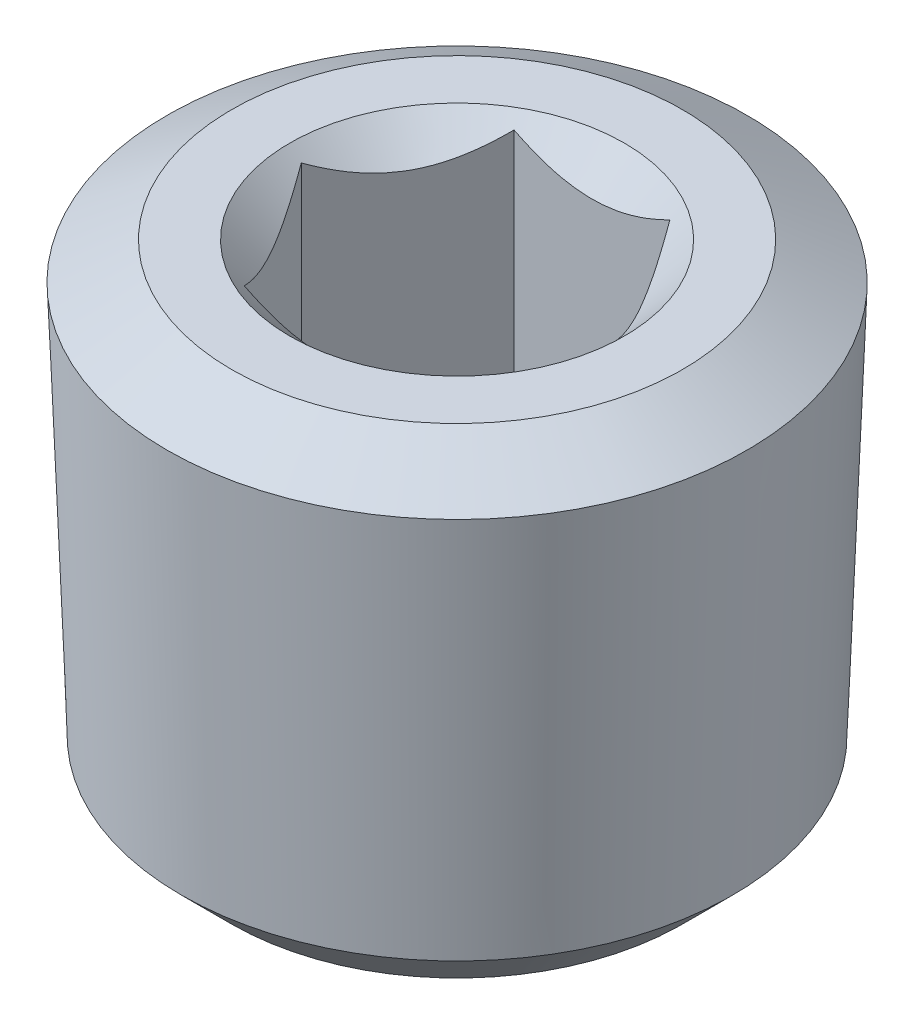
SolidWorks part; units mm, degrees
ref_plane "Front Plane" through (0, 0, 0) normal (0, 0, 1) x (1, 0, 0)
ref_plane "Top Plane" through (0, 0, 0) normal (0, 1, 0) x (1, 0, 0)
ref_plane "Right Plane" through (0, 0, 0) normal (1, 0, 0) x (0, 0, -1)
sketch "Sketch2" plane through (0, 0, 0) normal (0, 0, 1) x (1, 0, 0)
  line L0 (0, 10.7443) -> (0, -17.0657) construction
  line L1 (0, 0) -> (-5.3029, 0)
  line L2 (-6.8259, -0.8793) -> (-6.4892, -10.1168)
  line L3 (-5.3029, -11.303) -> (0, -11.303)
  line L4 (0, -11.303) -> (0, 0)
  line L6 (-5.3029, -11.303) -> (-6.4892, -10.1168)
  line L7 (-5.3029, 0) -> (-6.8259, -0.8793)
  point P4 (-6.858, 0)
  point P6 (-6.4459, -11.303)
  dimension "D1" = 11.303
  dimension "D2" = 2.088
  dimension "D3" = 13.716
  dimension "D4" = 30
  dimension "D5" = 1.143
  dimension "D6" = 45
revolve "Revolve1" add sketch "Sketch2" angle 360 about L0
sketch "Sketch3" plane through (0, 0, 0) normal (0, 0, 1) x (1, 0, 0)
  line L0 (0, 2.9342) -> (0, -8.1202) construction
  line L1 (0, 0) -> (-3.937, 0)
  line L2 (5.3029, 0) -> (-5.3029, 0) construction
  line L3 (-3.175, -0.762) -> (-3.175, -6.35)
  line L4 (-3.175, -6.35) -> (0, -8.2577)
  line L5 (0, -8.2577) -> (0, 0)
  line L6 (-3.175, -0.762) -> (-3.937, 0)
  dimension "D1" = 6.35
  dimension "D2" = 59
  dimension "D3" = 6.35
  dimension "D4" = 0.762
  dimension "D5" = 45
revolve "Cut-Revolve1" cut sketch "Sketch3" angle 360 about L0
sketch "Sketch4" plane through (0, 0, 0) normal (0, 1, 0) x (1, 0, 0)
  line L1 (-1.8331, -3.175) -> (1.8331, -3.175)
  line L2 (1.8331, -3.175) -> (3.6662, 0)
  line L3 (3.6662, 0) -> (1.8331, 3.175)
  line L4 (1.8331, 3.175) -> (-1.8331, 3.175)
  line L5 (-1.8331, 3.175) -> (-3.6662, 0)
  line L6 (-3.6662, 0) -> (-1.8331, -3.175)
  circle A0 centre (0, 0) radius 3.175 construction
  circle A1 centre (0, 0) radius 3.175 construction
extrude "Cut-Extrude1" cut sketch "Sketch4" against normal up to vertex (5.2929 mm away)
